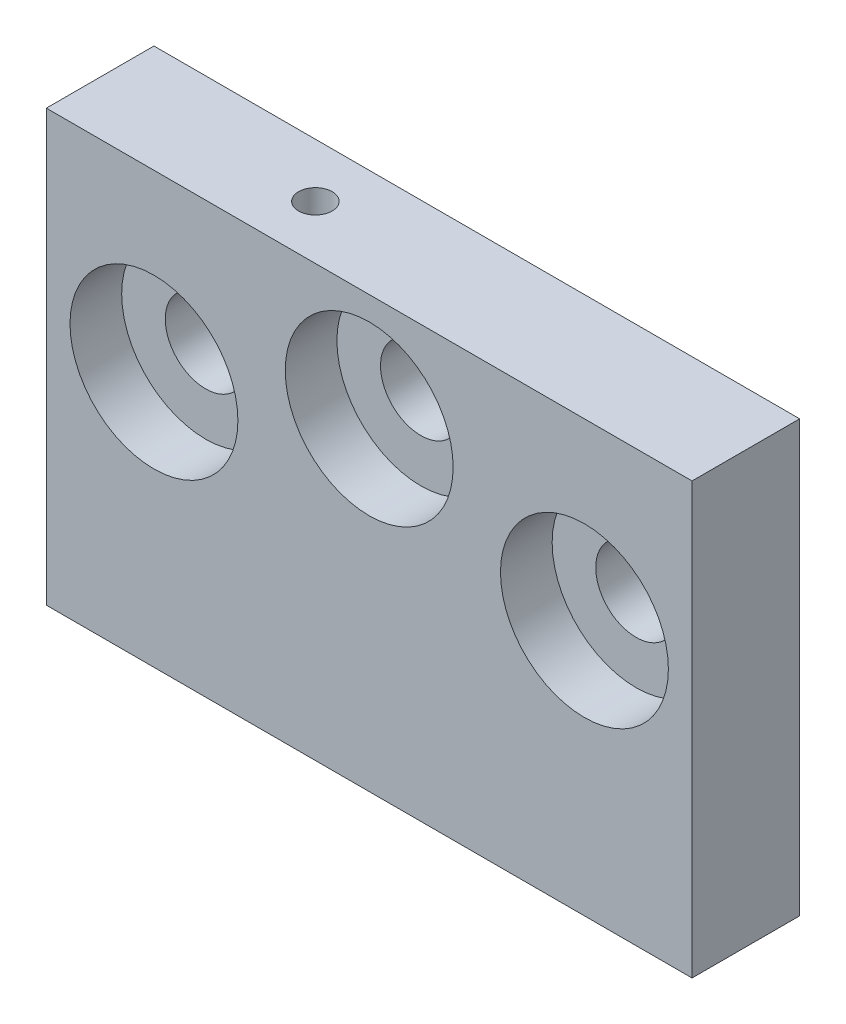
SolidWorks part; units mm, degrees
ref_plane "Front Plane" through (0, 0, 0) normal (0, 0, 1) x (1, 0, 0)
ref_plane "Top Plane" through (0, 0, 0) normal (0, 1, 0) x (1, 0, 0)
ref_plane "Right Plane" through (0, 0, 0) normal (1, 0, 0) x (0, 0, -1)
sketch "Sketch1" plane through (0, 0, 0) normal (0, 0, 1) x (1, 0, 0)
  line L0 (0, 0) -> (0, 2.794) construction
  line L1 (38.1, 25.4) -> (-38.1, 25.4)
  line L2 (38.1, 25.4) -> (38.1, -25.4)
  line L3 (38.1, -25.4) -> (-38.1, -25.4)
  line L4 (-38.1, 25.4) -> (-38.1, -25.4)
  line L5 (38.1, 25.4) -> (-38.1, -25.4) construction
  line L6 (38.1, -25.4) -> (-38.1, 25.4) construction
  line L7 (-12.7, 25.4) -> (-12.7, -25.4) construction
  circle A0 centre (0, 12.7) radius 4.7625
  circle A1 centre (-25.4, 4.7752) radius 4.7625
  circle A2 centre (25.4, 4.7752) radius 4.7625
  circle A3 centre (-25.4, 4.7752) radius 9.906
  circle A4 centre (0, 12.7) radius 9.906
  circle A5 centre (25.4, 4.7752) radius 9.906
  point P0 (0, 0)
  dimension "D3" = 9.525
  dimension "D4" = 9.525
  dimension "D8" = 19.812
  dimension "D9" = 19.812
  dimension "D1" = 50.8
  dimension "D2" = 76.2
  dimension "D5" = 12.7
  dimension "D6" = 7.9248
  dimension "D7" = 50.8
  dimension "D10" = 25.4
sketch "Sketch2" plane through (0, 0, 0) normal (0, 0, 1) x (1, 0, 0)
  line L0 (-38.1, 25.4) -> (-38.1, -25.4) construction
  line L1 (38.1, -25.4) -> (-38.1, -25.4) construction
  line L2 (38.1, 25.4) -> (38.1, -25.4) construction
  line L3 (38.1, 25.4) -> (-38.1, 25.4) construction
  line L4 (-38.1, 25.4) -> (-38.1, -25.4)
  line L5 (38.1, -25.4) -> (-38.1, -25.4)
  line L6 (38.1, 25.4) -> (38.1, -25.4)
  line L7 (38.1, 25.4) -> (-38.1, 25.4)
  circle A0 centre (-25.4, 4.7752) radius 4.7625 construction
  circle A1 centre (0, 12.7) radius 4.7625 construction
  circle A2 centre (25.4, 4.7752) radius 4.7625 construction
  circle A3 centre (-25.4, 4.7752) radius 4.7625
  circle A4 centre (0, 12.7) radius 4.7625
  circle A5 centre (25.4, 4.7752) radius 4.7625
extrude "Boss-Extrude1" add sketch "Sketch2" against normal blind 12.7
sketch "Sketch3" plane through (0, 0, 0) normal (0, 0, 1) x (1, 0, 0)
  circle A0 centre (-25.4, 4.7752) radius 9.906 construction
  circle A1 centre (0, 12.7) radius 9.906 construction
  circle A2 centre (25.4, 4.7752) radius 9.906 construction
  circle A3 centre (-25.4, 4.7752) radius 9.906
  circle A4 centre (0, 12.7) radius 9.906
  circle A5 centre (25.4, 4.7752) radius 9.906
extrude "Cut-Extrude1" cut sketch "Sketch3" against normal blind 6.096
sketch "Sketch4" plane through (0, -25.4, 0) normal (0, -1, 0) x (1, 0, 0)
  line L0 (-12.7, 0) -> (-12.7, -6.35) construction
  circle A0 centre (-12.7, -6.35) radius 2.9718
  circle A1 centre (-12.7, -6.35) radius 1.9812
  dimension "D1" = 3.9624
  dimension "D2" = 5.9436
  dimension "D3" = 6.35
sketch "Sketch5" plane through (0, -25.4, 0) normal (0, -1, 0) x (1, 0, 0)
  circle A0 centre (-12.7, -6.35) radius 1.9812 construction
  circle A1 centre (-12.7, -6.35) radius 1.9812
extrude "Cut-Extrude2" cut sketch "Sketch5" against normal blind 76.2
sketch "Sketch6" plane through (0, -25.4, 0) normal (0, -1, 0) x (1, 0, 0)
  circle A0 centre (-12.7, -6.35) radius 2.9718 construction
  circle A1 centre (-12.7, -6.35) radius 2.9718
extrude "Cut-Extrude3" cut sketch "Sketch6" against normal blind 15.875
sketch "Sketch7" plane through (0, -9.525, 0) normal (0, -1, 0) x (1, 0, 0)
  point P0 (-12.7, -6.35)
